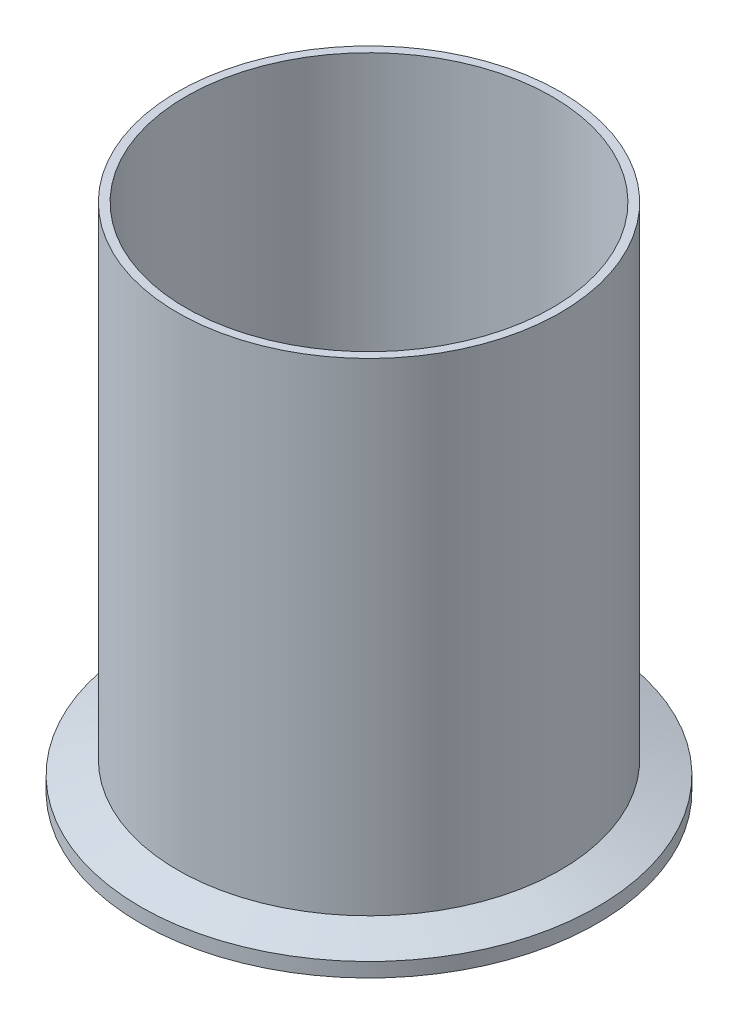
SolidWorks part; units mm, degrees
ref_plane "Front Plane" through (0, 0, 0) normal (0, 0, 1) x (1, 0, 0)
ref_plane "Top Plane" through (0, 0, 0) normal (0, 1, 0) x (1, 0, 0)
ref_plane "Right Plane" through (0, 0, 0) normal (1, 0, 0) x (0, 0, -1)
sketch "Sketch1" plane through (0, 0, 0) normal (0, 0, 1) x (1, 0, 0)
  line L0 (0, 0) -> (0, 101.6) construction
  line L1 (0, 101.6) -> (-38.1, 101.6)
  line L2 (-38.1, 101.6) -> (-38.1, 5.5212)
  line L3 (-38.1, 5.5212) -> (-45.4533, 2.8448)
  line L4 (-45.4533, 2.8448) -> (-45.4533, 0)
  line L5 (-45.4533, 0) -> (-43.4867, 0)
  line L6 (-39.8507, 0) -> (0, 0)
  line L7 (0, 0) -> (0, 101.6)
  line L8 (0, 101.6) -> (-36.449, 101.6)
  line L9 (-36.449, 101.6) -> (-36.449, 0)
  line L10 (-36.449, 0) -> (0, 0)
  line L11 (0, 0) -> (-0.1846, 0.0129)
  arc A0 (-42.7642, 0.4745) -> (-40.5732, 0.4745) centre (-41.6687, 0) cw
  arc A1 (-39.8507, 0) -> (-40.5732, 0.4745) centre (-39.8507, 0.7874) cw
  arc A2 (-42.7642, 0.4745) -> (-43.4867, 0) centre (-43.4867, 0.7874) cw
  point P12 (-40.4749, 0)
  dimension "D6" = 1.1938
  dimension "D7" = 0.7874
  dimension "D1" = 38.1
  dimension "D2" = 2.8448
  dimension "D3" = 45.4533
  dimension "D4" = 70
  dimension "D5" = 41.6687
  dimension "D8" = 1.651
  dimension "D9" = 101.6
revolve "Revolve2" add sketch "Sketch1" angle 360 about L0
